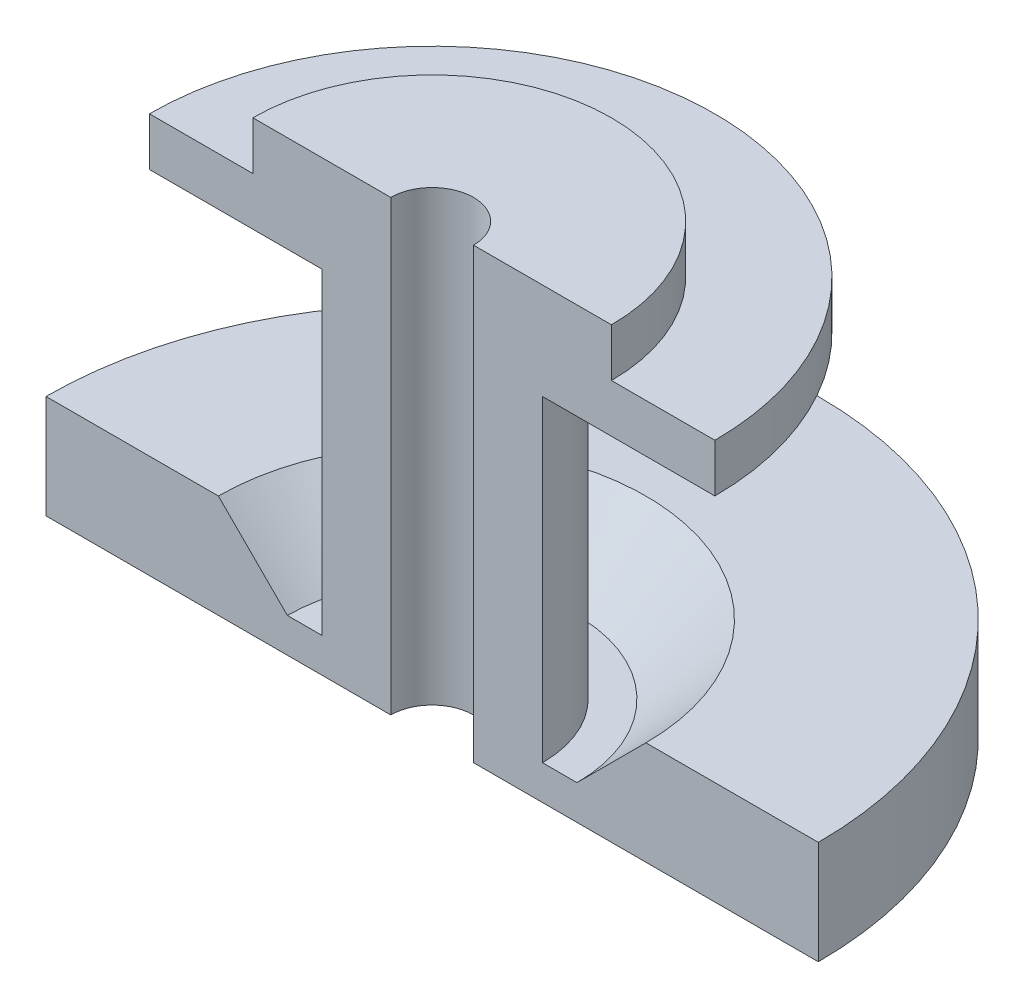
SolidWorks part; units mm, degrees
ref_plane "Front Plane" through (0, 0, 0) normal (0, 0, 1) x (1, 0, 0)
ref_plane "Top Plane" through (0, 0, 0) normal (0, 1, 0) x (1, 0, 0)
ref_plane "Right Plane" through (0, 0, 0) normal (1, 0, 0) x (0, 0, -1)
sketch "Sketch1" plane through (0, 0, 0) normal (0, 0, 1) x (-1, 0, 0)
  line L0 (0, 0) -> (0, 77.9105) construction
  line L1 (-26, 0) -> (-6, 0)
  line L2 (-26, 0) -> (-26, 7)
  line L3 (-26, 7) -> (-41, 7)
  line L4 (-41, 7) -> (-41, 14)
  line L5 (-41, 14) -> (-16, 14)
  line L6 (-16, 14) -> (-16, 60)
  line L7 (-16, 60) -> (-21, 60)
  line L8 (-21, 60) -> (-31, 50)
  line L9 (-31, 50) -> (-56, 50)
  line L10 (-56, 50) -> (-56, 65)
  line L11 (-56, 65) -> (-6, 65)
  line L12 (-6, 0) -> (-6, 65)
  dimension "D2" = 6
  dimension "D3" = 20
  dimension "D4" = 35
  dimension "D5" = 7
  dimension "D6" = 14
  dimension "D7" = 50
  dimension "D8" = 65
  dimension "D9" = 50
  dimension "D10" = 135
  dimension "D11" = 60
  dimension "D12" = 25
  dimension "D13" = 10
revolve "Revolve1" add sketch "Sketch1" angle 180 about L0
